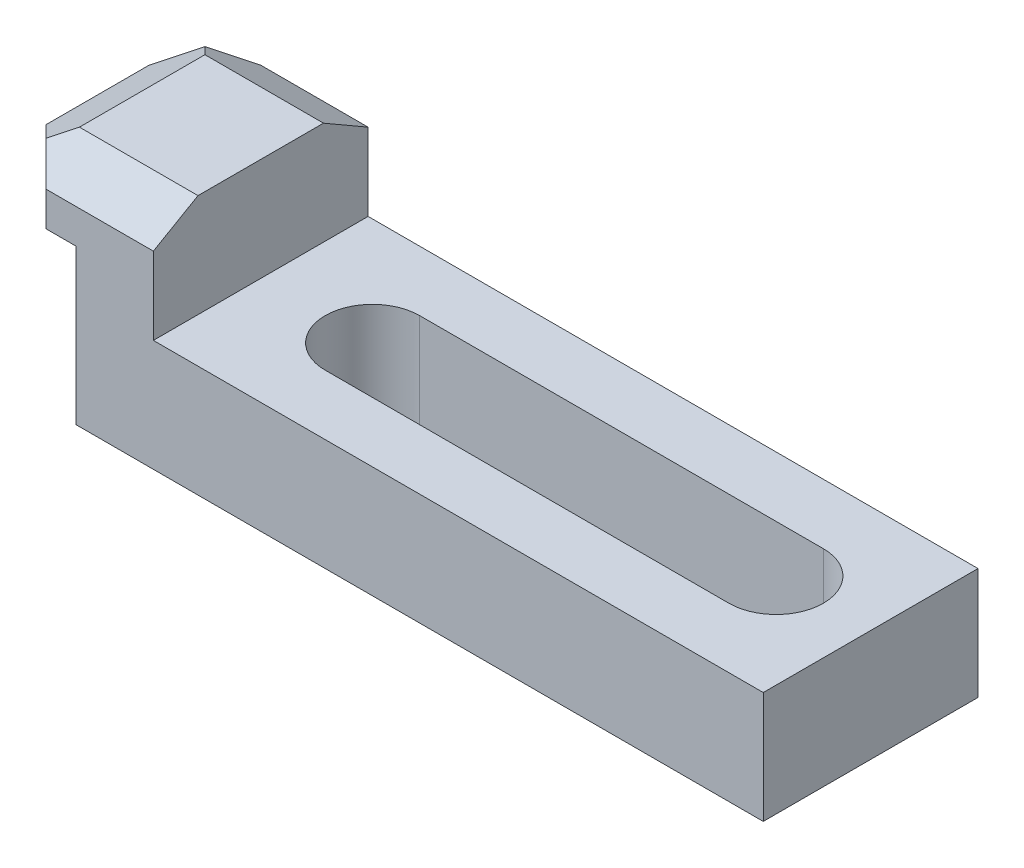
SolidWorks part; units mm, degrees
ref_plane "Front Plane" through (0, 0, 0) normal (0, 0, 1) x (1, 0, 0)
ref_plane "Top Plane" through (0, 0, 0) normal (0, 1, 0) x (1, 0, 0)
ref_plane "Right Plane" through (0, 0, 0) normal (1, 0, 0) x (0, 0, -1)
sketch "Sketch1" plane through (0, 0, 0) normal (0, 0, 1) x (1, 0, 0)
  line L0 (0, 0) -> (10, 0)
  line L1 (10, 0) -> (10, -18)
  line L2 (10, -18) -> (90, -18)
  line L3 (90, -18) -> (90, -5)
  line L4 (90, -5) -> (19, -5)
  line L5 (19, -5) -> (19, 7)
  line L6 (19, 7) -> (0, 7)
  line L7 (0, 7) -> (0, 0)
  dimension "D1" = 10
  dimension "D2" = 18
  dimension "D3" = 90
  dimension "D4" = 19
  dimension "D5" = 13
  dimension "D6" = 25
extrude "Extrude1" add sketch "Sketch1" along normal mid plane 25
chamfer "Chamfer1" distance 3 angle 60 4 edges at (9.5, 7, -12.5) (0, 7, 0) (9.5, 7, 12.5) (19, 7, 0)
sketch "Sketch2" plane through (0, -18, 0) normal (0, -1, 0) x (1, 0, 0)
  line L0 (0, 0) -> (50000, 0) construction
  line L1 (32, 5.5) -> (79, 5.5)
  line L2 (0, 12.5) -> (6.5, 12.5)
  line L4 (6.5, 12.5) -> (0, 6)
  line L5 (0, 12.5) -> (0, -12.5) construction
  line L6 (0, 6) -> (0, 12.5)
  line L7 (32, -5.5) -> (79, -5.5)
  line L8 (0, -6) -> (0, -12.5)
  line L9 (6.5, -12.5) -> (0, -6)
  line L10 (0, -12.5) -> (6.5, -12.5)
  arc A0 (32, 5.5) -> (32, -5.5) centre (32, 0) ccw
  arc A1 (79, -5.5) -> (79, 5.5) centre (79, 0) ccw
  point P18 (26.5, 0)
  point P19 (84.5, 0)
  dimension "D1" = 45
  dimension "D2" = 12
  dimension "D3" = 26.5
  dimension "D4" = 11
  dimension "D5" = 58
extrude "Extrude2" cut sketch "Sketch2" against normal through all
